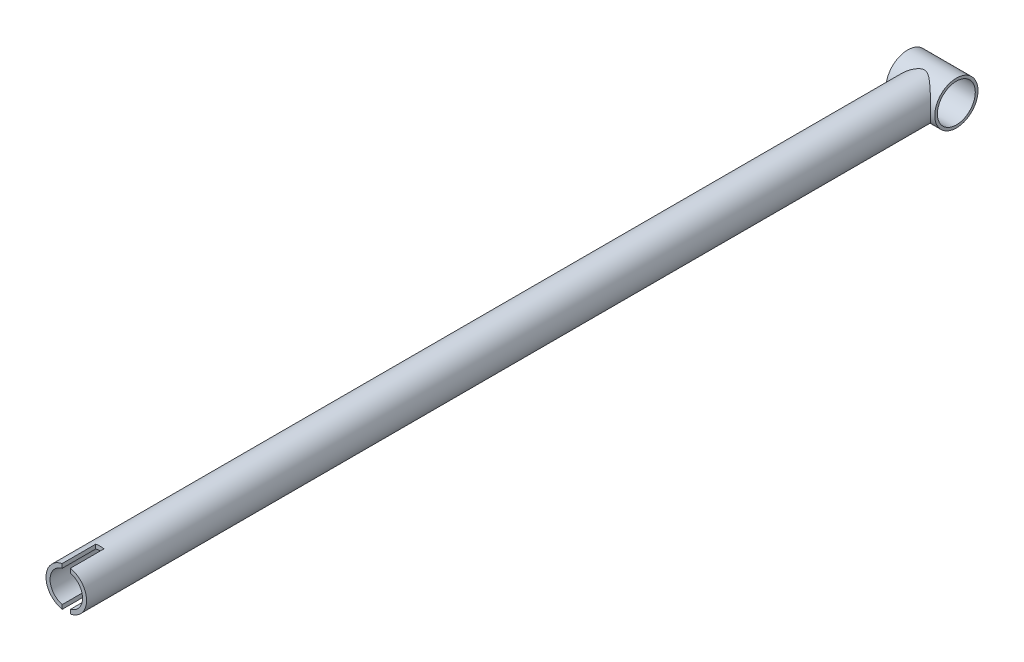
SolidWorks part; units mm, degrees
ref_plane "FRONT" through (0, 0, 0) normal (0, 0, 1) x (1, 0, 0)
ref_plane "TOP" through (0, 0, 0) normal (0, 1, 0) x (1, 0, 0)
ref_plane "RT-SIDE" through (0, 0, 0) normal (1, 0, 0) x (0, 0, -1)
sketch "Sketch1" plane through (0, 0, 0) normal (0, 0, 1) x (1, 0, 0)
  circle A0 centre (0, 0) radius 19.05
  circle A1 centre (0, 0) radius 23.8125
  dimension "D1" = 38.1
  dimension "D2" = 47.625
extrude "Base-Extrude" add sketch "Sketch1" along normal blind 1016
sketch "Sketch2" plane through (0, 0, 0) normal (0, 1, 0) x (0, 0, -1)
  line L0 (-1764.2659, 0) -> (-1712.8921, 0) construction
  line L1 (-1016, 0) -> (0, 0) construction
  line L2 (-1016, 23.8125) -> (-1016, -23.8125) construction
  line L3 (-1738.579, 4.826) -> (-976.63, 4.826)
  line L4 (-1738.579, 4.826) -> (-1738.579, -4.826)
  line L5 (-1738.579, -4.826) -> (-976.63, -4.826)
  line L6 (-976.63, 4.826) -> (-976.63, -4.826)
  point P8 (-1738.579, 0)
  dimension "D1" = 9.652
  dimension "D2" = 39.37
extrude "Cut-Extrude1" cut sketch "Sketch2" against normal mid plane 50.8
mirror "Mirror1" about plane through (0, 0, 0) normal (0, 0, 1)
mirror "Mirror2" about plane through (0, 0, 0) normal (0, 0, 1)
sketch "Sketch4" plane through (0, 0, 0) normal (1, 0, 0) x (0, -1, 0)
  circle A0 centre (0, 0) radius 22.225
  circle A1 centre (0, 0) radius 25.4
  dimension "D1" = 50.8
  dimension "D2" = 44.45
extrude "Boss-Extrude1" add sketch "Sketch4" along normal mid plane 57.15
sketch "Sketch5" plane through (0, 0, 0) normal (1, 0, 0) x (0, 0, -1)
  circle A0 centre (0, 0) radius 22.225
  circle A1 centre (0, 0) radius 22.225 construction
extrude "Cut-Extrude2" cut sketch "Sketch5" against normal mid plane 63.5
ref_plane "Plane1" through (-23.8125, 0, 0) normal (1, 0, 0) x (0, 0, -1)
sketch "Sketch6" plane through (-23.8125, 0, 0) normal (1, 0, 0) x (0, 0, -1)
  line L0 (-133.8503, -38.1) -> (-133.8503, 0)
  line L3 (-133.8503, 0) -> (-108.4503, 0)
  line L4 (-121.1503, -38.1) -> (-121.1503, -80.0286) construction
  line L5 (0, 0) -> (-132.1547, 0) construction
  line L7 (-108.4503, -38.1) -> (-108.4503, 0)
  arc A0 (-133.8503, -38.1) -> (-108.4503, -38.1) centre (-121.1503, -38.1) ccw
  circle A1 centre (-121.1503, -38.1) radius 6.35
  dimension "D1" = 38.1
  dimension "D2" = 12.7
  dimension "D3" = 127
  dimension "D4" = 12.7
extrude "Extrude1" add sketch "Sketch6" against normal blind 6.35
mirror "Mirror3" about plane through (0, 0, 0) normal (0, 1, 0)
chamfer "Chamfer1" distance 2.54 angle 45
